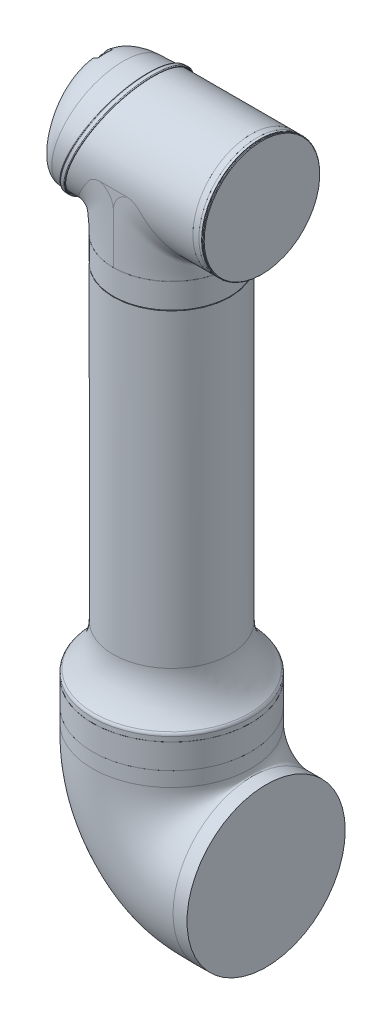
SolidWorks part; units mm, degrees
ref_plane "前视基准面" through (0, 0, 0) normal (0, 0, 1) x (1, 0, 0)
ref_plane "上视基准面" through (0, 0, 0) normal (0, 1, 0) x (1, 0, 0)
ref_plane "右视基准面" through (0, 0, 0) normal (1, 0, 0) x (0, 0, -1)
imported_body "CS612-Link2A-1-solid1"
imported_body "CS612-Link2B-1-solid1"
imported_body "CS612-Link2B-1-solid2"
imported_body "CS612-Link2B-1-solid3"
imported_body "CS612-J6-1-solid1"
imported_body "CS612-J6-1-solid2"
imported_body "CS612-J6-1-solid3"
imported_body "CS612-J6-1-solid4"
imported_body "CS612-J6-1-solid5"
imported_body "CS612-J6-1-solid6"
imported_body "CS612-J6-1-solid7"
imported_body "CS612-J6-1-solid8"
imported_body "CS612-J6-1-solid9"
imported_body "CS612-J6-1-solid10"
ref_plane "基准面1" through (0, 250, 0) normal (0, 1, 0) x (1, 0, 0)
split "分割1" trim tools "基准面1" bodies to split 109 resulting bodies 120 121
other "移动面1" parameters "D1"=141
move or copy body "实体-移动/复制1" bodies to move or copy 106 121 107 copy no translate (0, 141, 0)
combine bodies "组合1" operation type add bodies to combine 124 122
